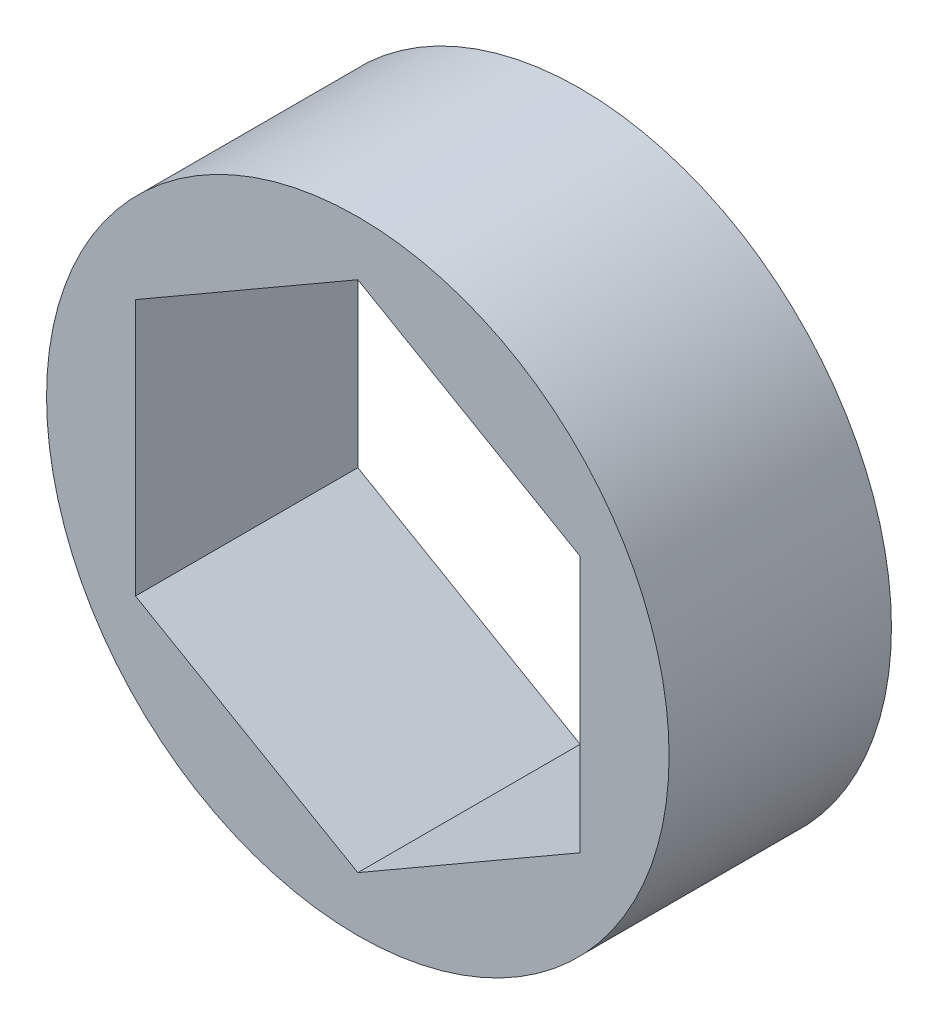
SolidWorks part; units mm, degrees
ref_plane "Front Plane" through (0, 0, 0) normal (0, 0, 1) x (1, 0, 0)
ref_plane "Top Plane" through (0, 0, 0) normal (0, 1, 0) x (1, 0, 0)
ref_plane "Right Plane" through (0, 0, 0) normal (1, 0, 0) x (0, 0, -1)
sketch "Sketch1" plane through (0, 0, 0) normal (0, 0, 1) x (1, 0, 0)
  line L1 (0, 7.3323) -> (-6.35, 3.6662)
  line L2 (-6.35, 3.6662) -> (-6.35, -3.6662)
  line L3 (-6.35, -3.6662) -> (0, -7.3323)
  line L4 (0, -7.3323) -> (6.35, -3.6662)
  line L5 (6.35, -3.6662) -> (6.35, 3.6662)
  line L6 (6.35, 3.6662) -> (0, 7.3323)
  circle A0 centre (0, 0) radius 6.35 construction
  circle A1 centre (0, 0) radius 8.89
  dimension "D2" = 17.78
  dimension "D1" = 12.7
extrude "Boss-Extrude1" add sketch "Sketch1" along normal blind 6.35
